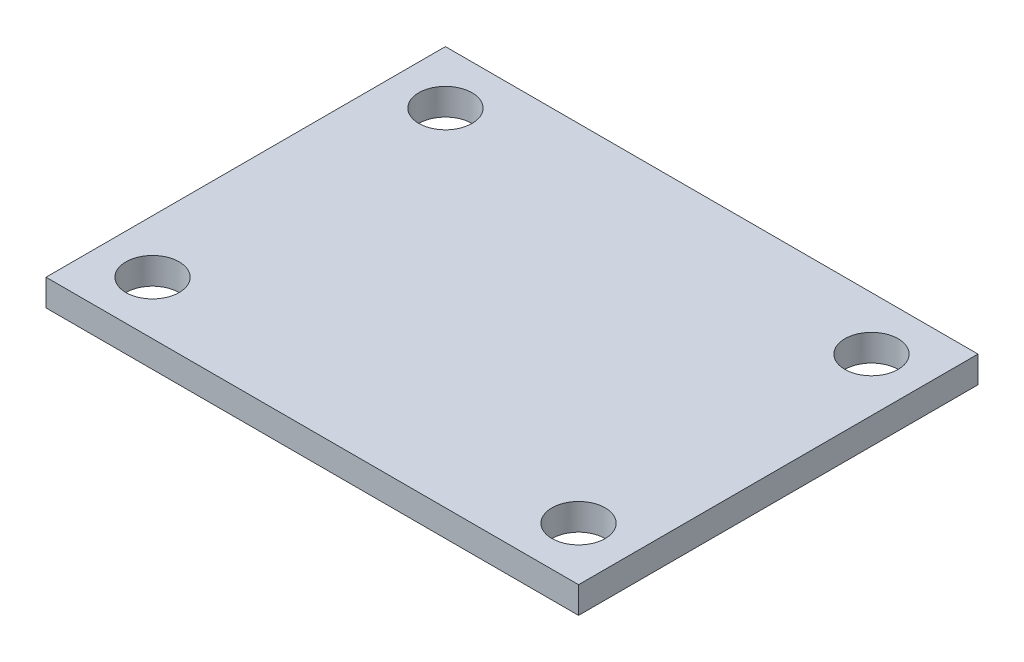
SolidWorks part; units mm, degrees
ref_plane "Front Plane" through (0, 0, 0) normal (0, 0, 1) x (1, 0, 0)
ref_plane "Top Plane" through (0, 0, 0) normal (0, 1, 0) x (1, 0, 0)
ref_plane "Right Plane" through (0, 0, 0) normal (1, 0, 0) x (0, 0, -1)
sketch "Sketch1" plane through (0, 0, 0) normal (0, 1, 0) x (1, 0, 0)
  line L1 (-100, -75) -> (100, -75)
  line L2 (-100, -75) -> (-100, 75)
  line L3 (-100, 75) -> (100, 75)
  line L4 (100, -75) -> (100, 75)
  line L5 (-100, -75) -> (100, 75) construction
  line L6 (-100, 75) -> (100, -75) construction
  point P0 (0, 0)
  dimension "D1" = 200
  dimension "D2" = 150
extrude "Boss-Extrude1" add sketch "Sketch1" along normal blind 10
sketch "Sketch2" plane through (0, 10, 0) normal (0, 1, 0) x (1, 0, 0)
  line L0 (100, 75) -> (-100, 75) construction
  line L1 (-100, 75) -> (-100, -75) construction
  line L2 (100, -75) -> (100, 75) construction
  line L3 (-100, -75) -> (100, -75) construction
  circle A0 centre (-80, 55) radius 10
  circle A1 centre (80, 55) radius 10
  circle A2 centre (-80, -55) radius 10
  circle A3 centre (80, -55) radius 10
  dimension "D3" = 20
  dimension "D1" = 20
  dimension "D2" = 20
  dimension "D4" = 20
  dimension "D5" = 20
extrude "Cut-Extrude1" cut sketch "Sketch2" against normal blind 20
